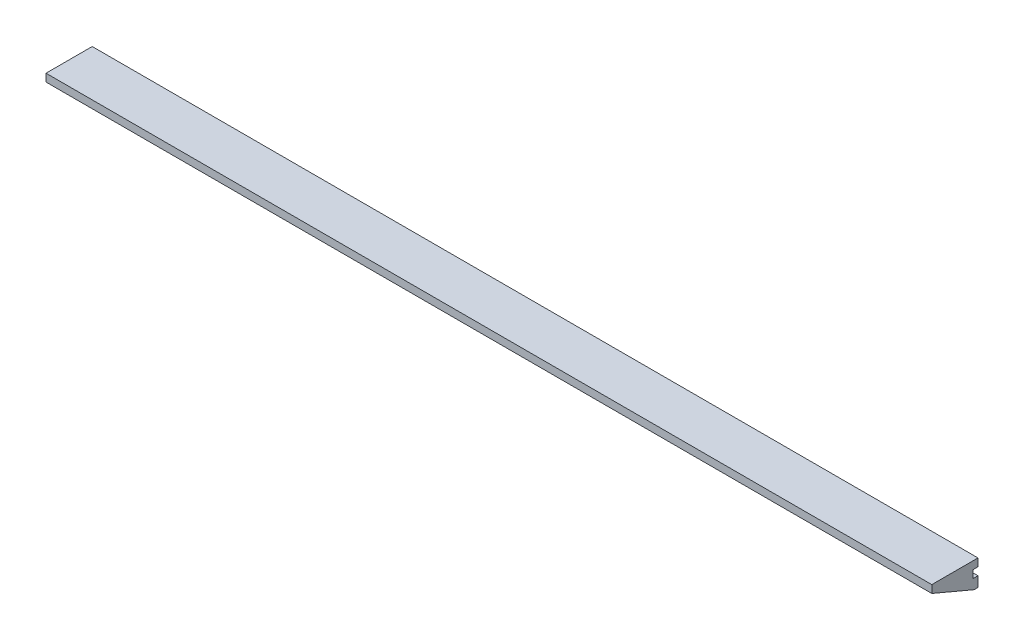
SolidWorks part; units mm, degrees
ref_plane "Front Plane" through (0, 0, 0) normal (0, 0, 1) x (1, 0, 0)
ref_plane "Top Plane" through (0, 0, 0) normal (0, 1, 0) x (1, 0, 0)
ref_plane "Right Plane" through (0, 0, 0) normal (1, 0, 0) x (0, 0, -1)
sketch "Sketch1" plane through (0, 0, 0) normal (1, 0, 0) x (0, 0, -1)
  line L0 (-19.05, 4.2037) -> (15.875, -10.5537)
  line L1 (15.875, -10.5537) -> (19.05, -10.5537)
  line L2 (-19.05, 4.2037) -> (-19.05, 10.5537)
  line L3 (-19.05, 10.5537) -> (19.05, 10.5537)
  line L4 (19.05, -10.5537) -> (19.05, -2.1463)
  line L5 (19.05, 4.2037) -> (19.05, 10.5537)
  line L6 (-19.05, 10.5537) -> (19.05, -10.5537) construction
  line L7 (19.05, 4.2037) -> (15.0876, 4.2037)
  line L9 (19.05, -2.1463) -> (15.0876, -2.1463)
  line L10 (15.0876, 4.2037) -> (15.0876, -2.1463)
  point P0 (0, 0)
  dimension "D1" = 38.1
  dimension "D2" = 21.1074
  dimension "D3" = 6.35
  dimension "D4" = 3.175
  dimension "D5" = 3.9624
  dimension "D6" = 6.35
  dimension "D7" = 6.35
extrude "Boss-Extrude1" add sketch "Sketch1" along normal mid plane 730.25
